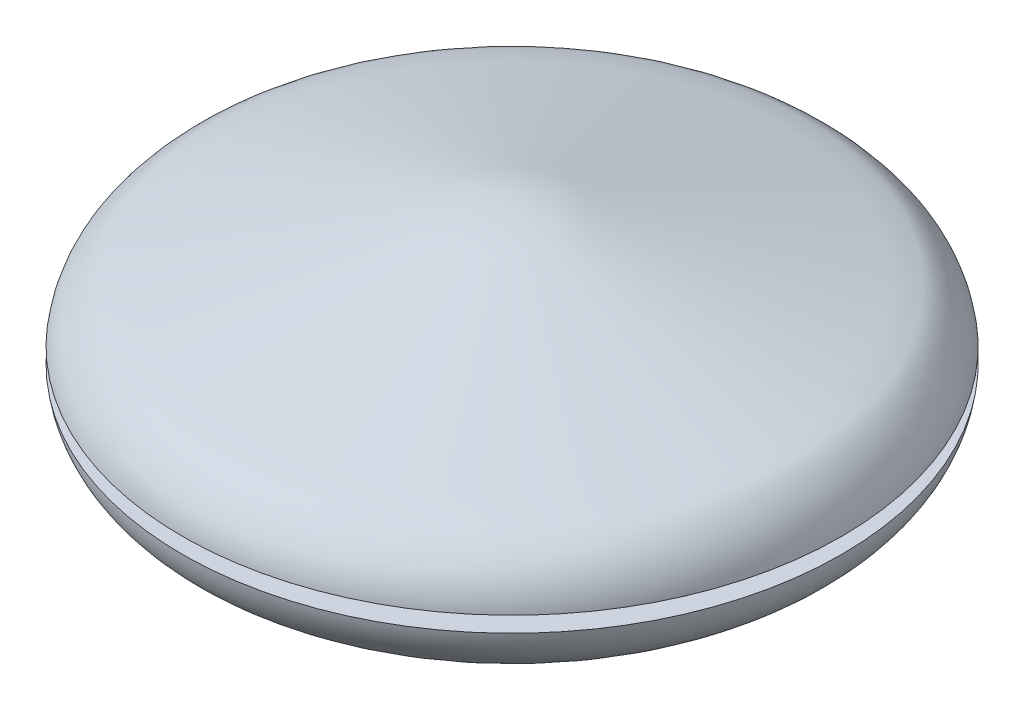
SolidWorks part; units mm, degrees
ref_plane "Front Plane" through (0, 0, 0) normal (0, 0, 1) x (1, 0, 0)
ref_plane "Top Plane" through (0, 0, 0) normal (0, 1, 0) x (1, 0, 0)
ref_plane "Right Plane" through (0, 0, 0) normal (1, 0, 0) x (0, 0, -1)
sketch "Sketch1" plane through (0, 0, 0) normal (0, 0, 1) x (1, 0, 0)
  line L1 (11.4831, 23.4929) -> (54.2256, 12.0767) construction
  line L2 (52.778, -12.3729) -> (6.3296, -19.0475) construction
  line L3 (0, 25) -> (0, -19.5) construction
  line L4 (0, -19.5) -> (0, 25)
  arc A0 (0, 25) -> (11.4831, 23.4929) centre (0, -19.5) cw construction
  arc A1 (54.2256, 12.0767) -> (52.778, -12.3729) centre (51, 0) cw construction
  arc A2 (6.3296, -19.0475) -> (0, -19.5) centre (0, 25) cw construction
  spline S0 degree 3 poles (0, 25) (2.9083, 25) (5.8026, 24.7158) (8.6554, 24.1501) (8.9718, 24.0874) (9.6032, 23.955) (10.5482, 23.7426) (11.1715, 23.5761) (11.4831, 23.4929) (11.7948, 23.4096) (12.418, 23.2432) (13.353, 22.9935) (13.9763, 22.827) (14.2879, 22.7437) (24.0386, 20.1394) (33.7893, 17.5351) (43.54, 14.9307) (44.7273, 14.6136) (47.1018, 13.9794) (50.6637, 13.028) (53.0383, 12.3938) (54.2256, 12.0767) (55.1262, 11.8361) (56.9275, 11.355) (59.3285, 9.4624) (60.589, 8.0728) (61.1346, 7.317) (64.7638, 2.2904) (64.3973, -3.8986) (60.2004, -8.4618) (59.5694, -9.148) (58.1537, -10.379) (55.5462, -11.9751) (53.7007, -12.2403) (52.778, -12.3729) (51.4878, -12.5583) (48.9073, -12.9291) (45.0366, -13.4853) (42.4561, -13.8562) (41.1659, -14.0416) (30.0777, -15.6349) (18.9894, -17.2283) (7.9012, -18.8217) (7.7266, -18.8468) (7.3773, -18.897) (6.8535, -18.9723) (6.5043, -19.0224) (6.3296, -19.0475) (6.155, -19.0726) (5.8058, -19.1228) (5.2803, -19.1867) (4.9297, -19.2265) (4.7543, -19.2453) (3.1748, -19.415) (1.5886, -19.5) (0, -19.5) knots 0 0 0 0 0.061376 0.061376 0.061376 0.068205 0.075034 0.081863 0.081863 0.081863 0.088692 0.095522 0.102351 0.102351 0.102351 0.316022 0.316022 0.316022 0.34204 0.368057 0.394075 0.394075 0.394075 0.413811 0.433547 0.453282 0.453282 0.453282 0.564831 0.564831 0.564831 0.584566 0.604302 0.624038 0.624038 0.624038 0.651635 0.679231 0.706828 0.706828 0.706828 0.943991 0.943991 0.943991 0.947726 0.951461 0.955196 0.955196 0.955196 0.958931 0.962666 0.9664 0.9664 0.9664 1 1 1 1 weights 1 0.996809 0.996809 1 1 1 1 1 1 1 1 1 1 1 1 1 1 1 1 1 1 1 1 1 1 1 1 0.849837 0.849837 1 1 1 1 1 1 1 1 1 1 1 1 1 1 1 1 1 1 1 1 1 1 1 1 0.999045 0.999045 1
  dimension "D2" = 44.5
  dimension "D4" = 12.5
  dimension "D1" = 25
  dimension "D3" = 127
revolve "Case Body" add sketch "Sketch1" angle 360 about L4
sketch "Sketch2" plane through (0, 0, 0) normal (0, 1, 0) x (1, 0, 0)
  circle A0 centre (0, 0) radius 63.5
  circle A1 centre (0, 0) radius 63.5
extrude "Edge Slot" cut sketch "Sketch2" against normal mid plane 3 thin
sketch "Groove Path" plane through (0, 0, 0) normal (0, 1, 0) x (1, 0, 0)
  line L0 (0, -81.6617) -> (0, 0) construction
  line L1 (0, 0) -> (28.547, 0) construction
  line L2 (-57.3237, -57.3237) -> (-22.4506, -22.4506)
  line L3 (57.3237, -57.3237) -> (22.4506, -22.4506)
  line L4 (57.3237, 57.3237) -> (22.4506, 22.4506) construction
  line L5 (-57.3237, 57.3237) -> (-22.4506, 22.4506) construction
  arc A0 (-22.4506, -22.4506) -> (22.4506, -22.4506) centre (0, -44.9013) cw
  arc A1 (-22.4506, 22.4506) -> (22.4506, 22.4506) centre (0, 44.9013) ccw construction
  dimension "D2" = 31.75
  dimension "D1" = 45
